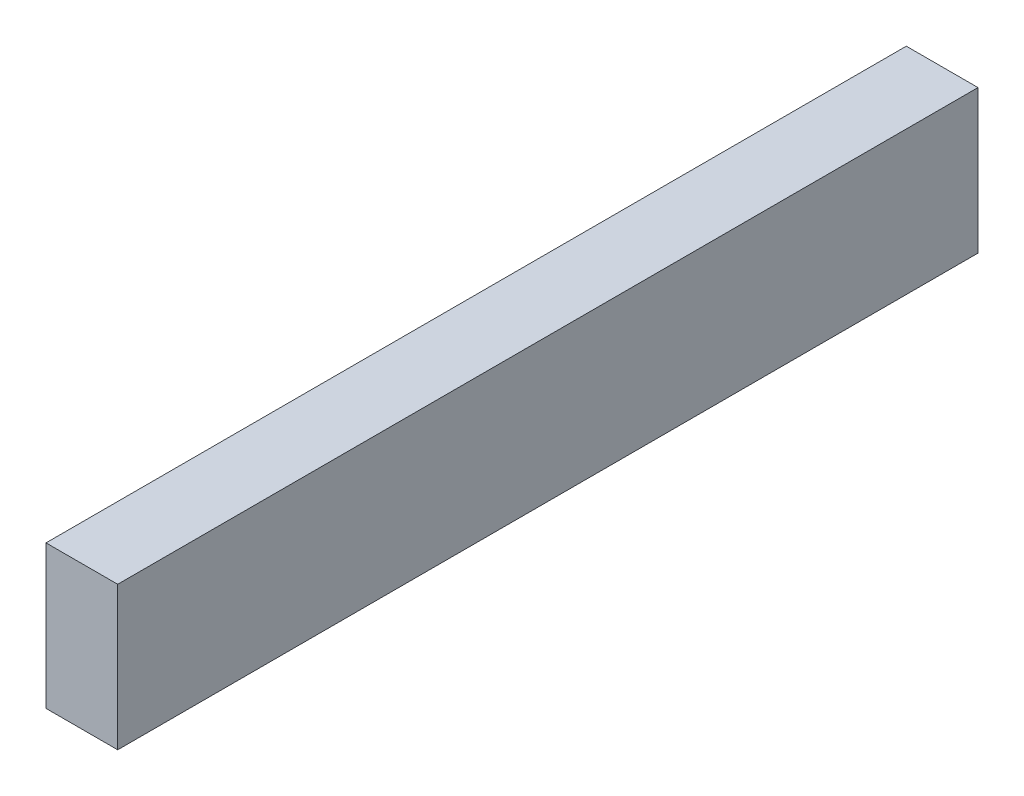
SolidWorks part; units mm, degrees
ref_plane "Plan de face" through (0, 0, 0) normal (0, 0, 1) x (1, 0, 0)
ref_plane "Plan de dessus" through (0, 0, 0) normal (0, 1, 0) x (1, 0, 0)
ref_plane "Plan de droite" through (0, 0, 0) normal (1, 0, 0) x (0, 0, -1)
sketch "Esquisse1" plane through (0, 0, 0) normal (0, 0, 1) x (1, 0, 0)
  line L1 (-2.5, 5) -> (2.5, 5)
  line L2 (-2.5, 5) -> (-2.5, -5)
  line L3 (-2.5, -5) -> (2.5, -5)
  line L4 (2.5, 5) -> (2.5, -5)
  point P4 (0, 5)
  point P5 (-2.5, 0)
  dimension "D1" = 5
  dimension "D2" = 10
extrude "Extrusion1" add sketch "Esquisse1" along normal mid plane 60
